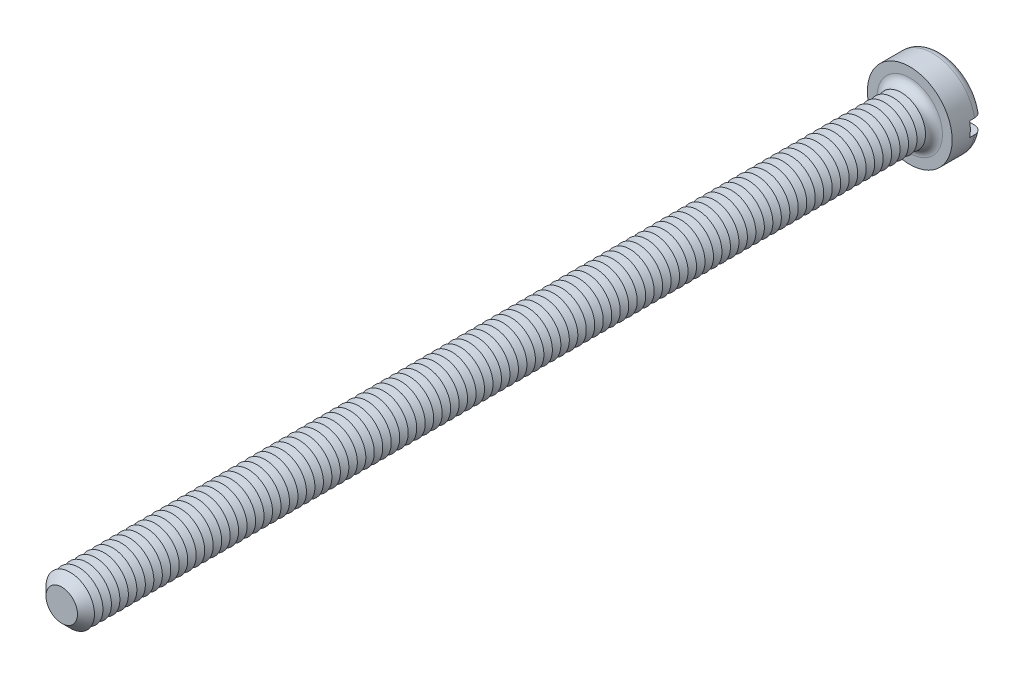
SolidWorks part; units mm, degrees
ref_plane "Front Plane" through (0, 0, 0) normal (0, 0, 1) x (1, 0, 0)
ref_plane "Top Plane" through (0, 0, 0) normal (0, 1, 0) x (1, 0, 0)
ref_plane "Right Plane" through (0, 0, 0) normal (1, 0, 0) x (0, 0, -1)
sketch "Sketch3" plane through (0, 0, 0) normal (0, 0, 1) x (1, 0, 0)
  circle A0 centre (0, 0) radius 3.5
  dimension "D1" = 7
extrude "Boss-Extrude2" add sketch "Sketch3" against normal blind 2.6
sketch "Sketch4" plane through (0, 0, 0) normal (0, 0, 1) x (1, 0, 0)
  circle A0 centre (0, 0) radius 2
  dimension "D1" = 4
extrude "Boss-Extrude3" add sketch "Sketch4" along normal blind 70
fillet "Fillet1" radius 0.7 2 edges at (3.5, 0, -2.6) (2, 0, 0)
chamfer "Chamfer1" distance 0.7 angle 45 1 edges at (2, 0, 70)
sketch "Sketch5" plane through (0, 0, 0) normal (1, 0, 0) x (0, 0, -1)
  line L0 (1.6944, 0) -> (-7.6738, 0) construction
sketch "Sketch6" plane through (0, 0, 0) normal (1, 0, 0) x (0, 0, -1)
  line L0 (-0.7, 2) -> (-1.05, 1.3938)
  line L1 (-1.05, 1.3938) -> (-1.4, 2)
  line L2 (-0.7, 2) -> (-69.3, 2) construction
  line L3 (-1.4, 2) -> (-0.7, 2)
  dimension "D1" = 0.7
revolve "Cut-Revolve1" cut sketch "Sketch6" angle 360 about L0
pattern_linear "LPattern1" count 98 spacing 0.7 along (0, 0, 1) of "Cut-Revolve1"
sketch "Sketch8" plane through (0, 0, -2.6) normal (0, 0, -1) x (-1, 0, 0)
  line L1 (3.5, -0.6) -> (-3.5, -0.6)
  line L2 (3.5, -0.6) -> (3.5, 0.6)
  line L3 (3.5, 0.6) -> (-3.5, 0.6)
  line L4 (-3.5, -0.6) -> (-3.5, 0.6)
  line L5 (3.5, -0.6) -> (-3.5, 0.6) construction
  line L6 (3.5, 0.6) -> (-3.5, -0.6) construction
  point P0 (0, 0)
  dimension "D1" = 7
  dimension "D2" = 1.2
extrude "Cut-Extrude1" cut sketch "Sketch8" against normal blind 1.1
